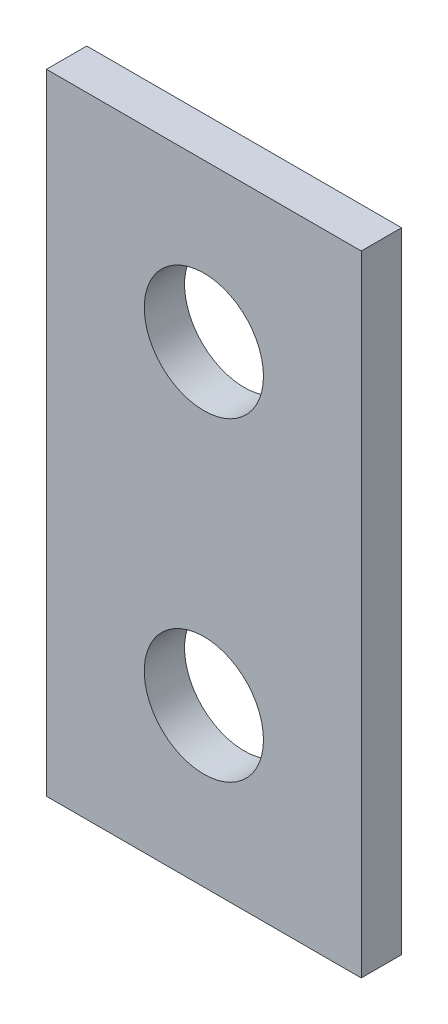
SolidWorks part; units mm, degrees
ref_plane "Front Plane" through (0, 0, 0) normal (0, 0, 1) x (1, 0, 0)
ref_plane "Top Plane" through (0, 0, 0) normal (0, 1, 0) x (1, 0, 0)
ref_plane "Right Plane" through (0, 0, 0) normal (1, 0, 0) x (0, 0, -1)
sketch "Sketch1" plane through (0, 0, 0) normal (0, 0, 1) x (1, 0, 0)
  line L1 (-4.7625, -9.525) -> (4.7625, -9.525)
  line L2 (-4.7625, -9.525) -> (-4.7625, 9.525)
  line L3 (-4.7625, 9.525) -> (4.7625, 9.525)
  line L4 (4.7625, -9.525) -> (4.7625, 9.525)
  line L5 (-4.7625, -9.525) -> (4.7625, 9.525) construction
  line L6 (-4.7625, 9.525) -> (4.7625, -9.525) construction
  point P0 (0, 0)
  dimension "D1" = 19.05
  dimension "D2" = 9.525
extrude "Boss-Extrude1" add sketch "Sketch1" against normal blind 1.2192
sketch "Sketch2" plane through (0, 0, 0) normal (0, 0, 1) x (1, 0, 0)
  line L1 (-1.2973, -4.7625) -> (1.2973, -4.7625) construction
  line L2 (-1.2973, -4.7625) -> (-1.2973, 4.7625) construction
  line L3 (-1.2973, 4.7625) -> (1.2973, 4.7625) construction
  line L4 (1.2973, -4.7625) -> (1.2973, 4.7625) construction
  line L5 (-1.2973, -4.7625) -> (1.2973, 4.7625) construction
  line L6 (-1.2973, 4.7625) -> (1.2973, -4.7625) construction
  circle A0 centre (0, 4.7625) radius 1.8034
  circle A1 centre (0, -4.7625) radius 1.8034
  point P0 (0, 0)
  dimension "D3" = 3.6068
  dimension "D1" = 9.525
  dimension "D2" = 2.5947
extrude "Cut-Extrude1" cut sketch "Sketch2" against normal through all
